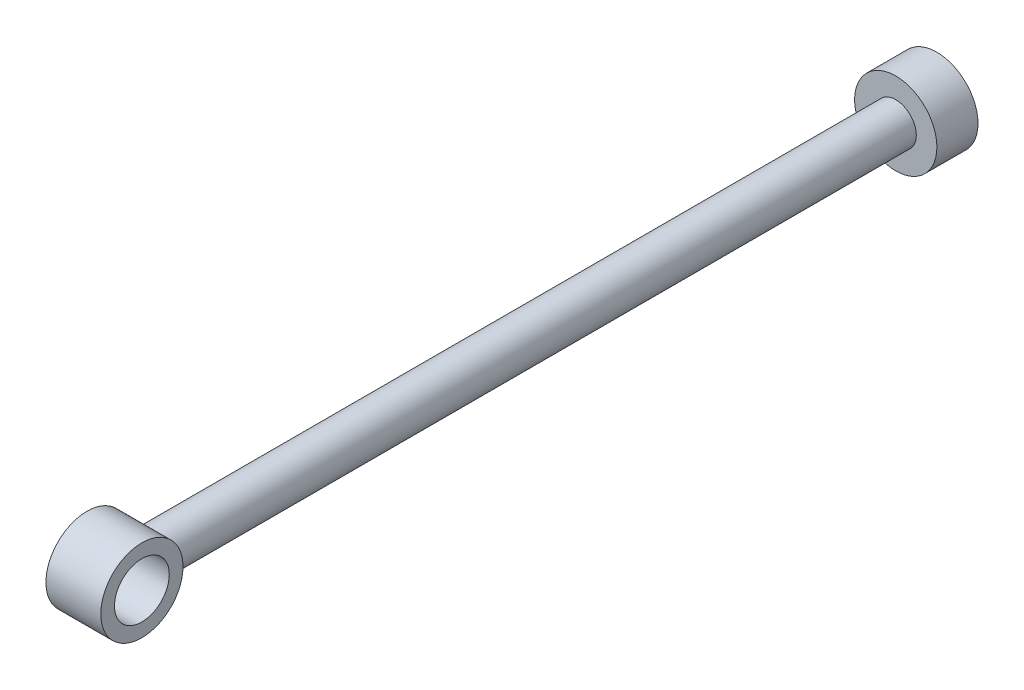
SolidWorks part; units mm, degrees
ref_plane "Płaszczyzna przednia" through (0, 0, 0) normal (0, 0, 1) x (1, 0, 0)
ref_plane "Płaszczyzna górna" through (0, 0, 0) normal (0, 1, 0) x (1, 0, 0)
ref_plane "Płaszczyzna prawa" through (0, 0, 0) normal (1, 0, 0) x (0, 0, -1)
sketch "Szkic1" plane through (0, 0, 0) normal (0, 0, 1) x (1, 0, 0)
  circle A0 centre (0, 0) radius 30
  dimension "D1" = 60
extrude "Dodanie-wyciągnięcie1" add sketch "Szkic1" along normal blind 30
sketch "Szkic2" plane through (0, 0, 30) normal (0, 0, 1) x (1, 0, 0)
  circle A0 centre (0, 0) radius 15
  dimension "D1" = 30
extrude "Dodanie-wyciągnięcie2" add sketch "Szkic2" along normal blind 545
sketch "Szkic3" plane through (0, 0, 0) normal (1, 0, 0) x (0, 0, -1)
  line L0 (-575, 15) -> (-575, -15) construction
  circle A0 centre (-600, 0) radius 20
  circle A1 centre (-600, 0) radius 30
  dimension "D1" = 40
  dimension "D3" = 60
  dimension "D2" = 25
extrude "Dodanie-wyciągnięcie3" add sketch "Szkic3" along normal mid plane 40
